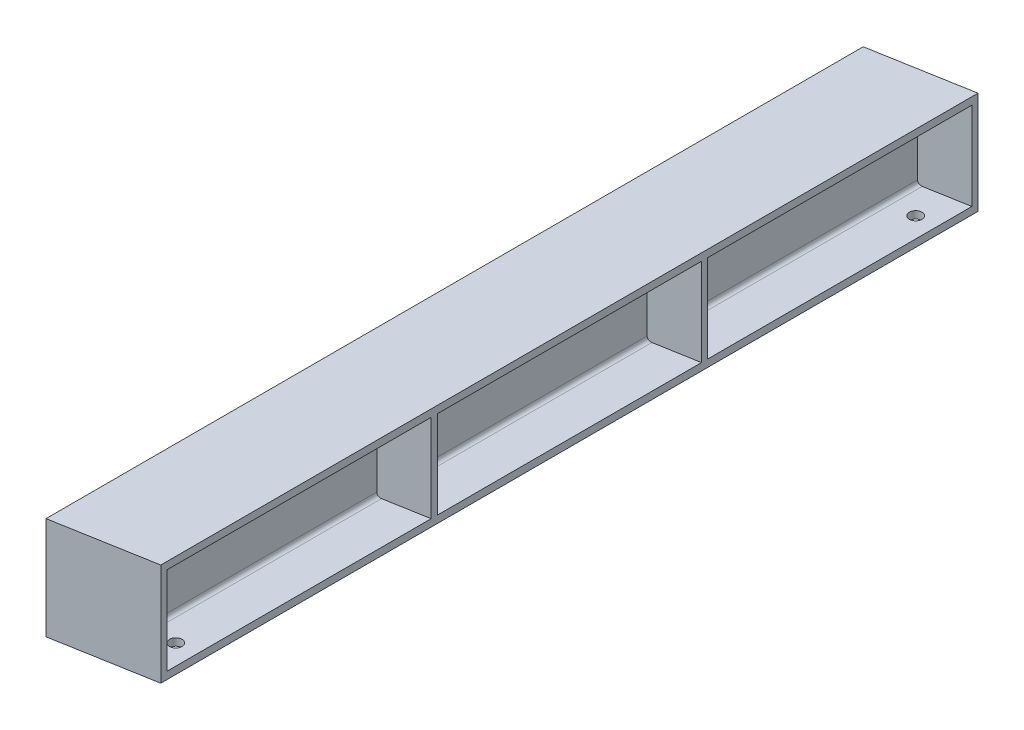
SolidWorks part; units mm, degrees
ref_plane "Plane1" through (0, 0, 0) normal (0, 0, 1) x (1, 0, 0)
ref_plane "Plane2" through (0, 0, 0) normal (0, 1, 0) x (1, 0, 0)
ref_plane "Plane3" through (0, 0, 0) normal (1, 0, 0) x (0, 0, -1)
sketch "Sketch1" plane through (0, 0, 0) normal (0, 0, 1) x (1, 0, 0)
  line L0 (0, 0) -> (0, 11.557)
  line L1 (0, 11.557) -> (66.802, 11.557)
  line L2 (73.152, 17.907) -> (73.152, 144.145)
  line L3 (66.802, 150.495) -> (0, 150.495)
  line L4 (0, 150.495) -> (0, 162.052)
  line L5 (0, 162.052) -> (154.432, 162.052)
  line L6 (154.432, 162.052) -> (154.432, 150.495)
  line L7 (154.432, 150.495) -> (87.63, 150.495)
  line L8 (81.28, 144.145) -> (81.28, 17.907)
  line L9 (87.63, 11.557) -> (154.432, 11.557)
  line L10 (154.432, 11.557) -> (154.432, 0)
  line L11 (154.432, 0) -> (0, 0)
  line L12 (77.216, -72.1361) -> (77.216, 162.052) construction
  arc A0 (66.802, 11.557) -> (73.152, 17.907) centre (66.802, 17.907) ccw
  arc A1 (73.152, 144.145) -> (66.802, 150.495) centre (66.802, 144.145) ccw
  arc A2 (87.63, 150.495) -> (81.28, 144.145) centre (87.63, 144.145) ccw
  arc A3 (81.28, 17.907) -> (87.63, 11.557) centre (87.63, 17.907) ccw
extrude "BaseSteelW" add sketch "Sketch1" against normal mid plane 1320.8
sketch "Sketch2" plane through (0, 162.052, 0) normal (0, 1, 0) x (1, 0, 0)
  line L0 (0, 660.4) -> (154.432, 660.4)
  line L1 (154.432, 660.4) -> (0, 633.1714)
  line L2 (0, 660.4) -> (0, -660.4) construction
  line L3 (0, 633.1714) -> (0, 660.4)
  line L4 (154.432, -660.4) -> (0, -660.4)
  line L5 (154.432, -660.4) -> (154.432, -633.1714)
  line L6 (154.432, 660.4) -> (154.432, -660.4) construction
  line L7 (154.432, -633.1714) -> (0, -660.4)
  dimension "D1" = 80.001
  dimension "D2" = 80.001
extrude "Cut-Extrude1" cut sketch "Sketch2" against normal through all
ref_plane "Plane4" through (77.216, 0, 0) normal (1, 0, 0) x (0, 0, -1)
sketch "Sketch6" plane through (0, 162.052, 0) normal (0, 1, 0) x (1, 0, 0)
  line L0 (0, 633.1714) -> (154.432, 660.4)
  line L1 (154.432, 660.4) -> (154.432, 650.7281)
  line L2 (154.432, 660.4) -> (154.432, -633.1714) construction
  line L3 (154.432, 650.7281) -> (0, 623.4995)
  line L4 (0, 633.1714) -> (0, -660.4) construction
  line L5 (0, 623.4995) -> (0, 633.1714)
  dimension "D1" = 9.525
extrude "Boss-Extrude2" add sketch "Sketch6" against normal up to surface (162.052 mm away)
pattern_linear "LPattern2" count 4 spacing 427.9665 along (0.1736, 0, 0.9848) of "Boss-Extrude2"
hole_wizard "3/4 Clearance Hole1" positions "Sketch4" profile "Sketch3" hole size "3/4" standard "Ansi Inch"
sketch "Sketch4" plane through (0, 11.557, 0) normal (0, 1, 0) x (-1, 0, 0)
  line L0 (0, -623.4995) -> (-66.802, -635.2777) construction
  line L1 (-66.802, 638.9499) -> (0, 650.7281) construction
  line L2 (-87.63, -638.9499) -> (-154.432, -650.7281) construction
  line L3 (-154.432, 623.4995) -> (-87.63, 635.2777) construction
  line L4 (-154.432, 205.2049) -> (-154.432, 623.4995) construction
  line L5 (-154.432, -650.7281) -> (-154.432, -232.4335) construction
  line L6 (0, -623.4995) -> (0, -205.2049) construction
  line L7 (0, 232.4335) -> (0, 650.7281) construction
  point P0 (-31.75, -577.5139)
  point P2 (-31.75, 593.5465)
  point P4 (-122.682, 577.5139)
  point P6 (-122.682, -593.5465)
  dimension "D1" = 50.8
  dimension "D2" = 50.8
  dimension "D3" = 50.8
  dimension "D4" = 50.8
  dimension "D5" = 31.75
  dimension "D6" = 31.75
  dimension "D7" = 31.75
  dimension "D8" = 31.75
sketch "Sketch3" plane through (31.75, 11.557, -577.5139) normal (1, 0, 0) x (0, 0, 1)
  line L0 (0, 0) -> (0, 11.557)
  line L1 (0, 11.557) -> (9.9212, 11.557)
  line L2 (9.9212, 11.557) -> (9.9212, 0)
  line L5 (9.9212, 0) -> (0, 0)
  line L11 (0, -6.35) -> (0, 107.95) construction
  dimension "Thru Hole Dia." = 19.8425
  dimension "Thru Hole Depth" = 11.557
sketch "No paint zone Bottom" plane through (0, 0, 0) normal (0, -1, 0) x (1, 0, 0)
  line L4 (0, -501.7938) -> (154.432, -529.0505)
  line L5 (0, -633.1714) -> (0, 660.4) construction
  line L6 (154.432, -660.4) -> (154.432, 633.1714) construction
  line L7 (0, 508.7882) -> (154.432, 481.5314)
sketch "No paint zone Top" plane through (0, 162.052, 0) normal (0, 1, 0) x (1, 0, 0)
  line L7 (154.432, -111.6904) -> (0, -111.6904)
  line L11 (154.432, -264.0904) -> (0, -264.0904)
  line L15 (154.432, 288.9041) -> (0, 248.4802)
  line L16 (154.432, 660.4) -> (154.432, -633.1714) construction
  line L17 (0, 633.1714) -> (0, -660.4) construction
  line L18 (154.432, 459.5665) -> (0, 419.1426)
sketch "No paint zone Bolts" plane through (0, 11.557, 0) normal (0, 1, 0) x (1, 0, 0)
  circle A0 centre (31.75, 577.5139) radius 19.05
  circle A1 centre (31.75, -593.5465) radius 19.05
  circle A2 centre (122.682, -577.5139) radius 19.05
  circle A3 centre (122.682, 593.5465) radius 19.05
  dimension "D1" = 38.1
ref_point "Point1"
equation "\"D1@Sketch1\" = \"Tw@Sketch1\" / 2"
equation "\"D2@Sketch1\" = \"Tf@Sketch1\""
